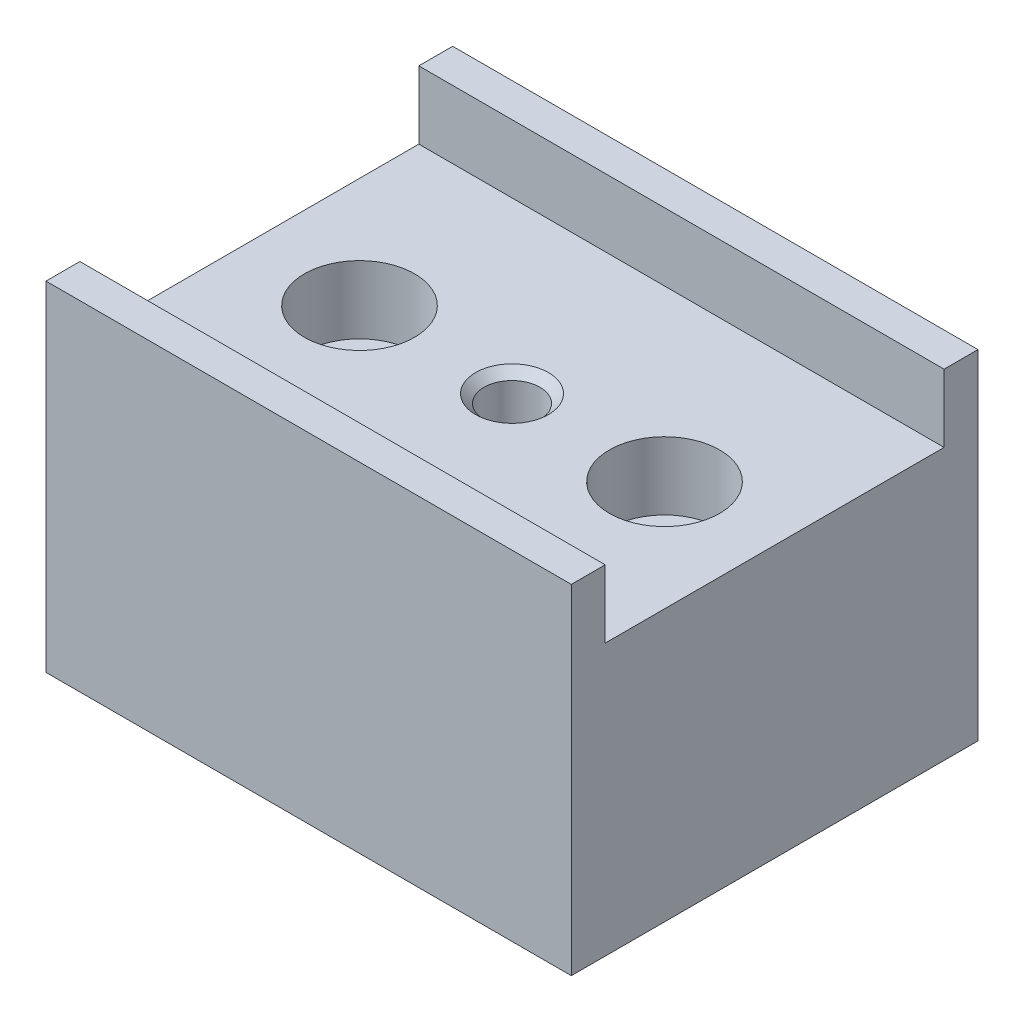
SolidWorks part; units mm, degrees
ref_plane "Спереди" through (0, 0, 0) normal (0, 0, 1) x (1, 0, 0)
ref_plane "Сверху" through (0, 0, 0) normal (0, 1, 0) x (1, 0, 0)
ref_plane "Справа" through (0, 0, 0) normal (1, 0, 0) x (0, 0, -1)
sketch "Эскиз1" plane through (0, 0, 0) normal (1, 0, 0) x (0, 0, -1)
  line L0 (0, 0) -> (0, 29.6441) construction
  line L1 (12, 0) -> (-12, 0)
  line L2 (-12, 0) -> (-12, 20)
  line L3 (-12, 20) -> (-10, 20)
  line L4 (-10, 20) -> (-10, 16)
  line L5 (-10, 16) -> (10, 16)
  line L6 (10, 20) -> (10, 16)
  line L7 (12, 20) -> (10, 20)
  line L8 (12, 0) -> (12, 20)
  point P9 (0, 16)
  dimension "D1" = 24
  dimension "D2" = 20
  dimension "D3" = 4
  dimension "D4" = 20
extrude "Бобышка-Вытянуть1" add sketch "Эскиз1" against normal blind 31
hole_wizard "Отверстие обработанное метчиком M41" positions "Эскиз3" profile "Эскиз2" tap size "M4" standard "DIN"
sketch "Эскиз3" plane through (0, 16, 0) normal (0, 1, 0) x (1, 0, 0)
  line L0 (-31, -12) -> (0, -12) construction
  point P0 (-15.5, 0)
  point P7 (-15.5, -12)
sketch "Эскиз2" plane through (-15.5, 16, 0) normal (1, 0, 0) x (0, 0, 1)
  line L0 (0, 0) -> (0, 16)
  line L1 (0, 16) -> (1.65, 16)
  line L2 (1.65, 16) -> (1.65, 0)
  line L5 (1.65, 0) -> (0, 0)
  line L11 (0, -6.35) -> (0, 107.95) construction
  dimension "Диаметр проходного сверла" = 3.3
  dimension "Глубина проходного сверла" = 16
chamfer "Фаска1" distance 0.5 angle 45 1 edges at (-15.5, 16, 1.65)
sketch "Эскиз4" plane through (0, 16, 0) normal (0, 1, 0) x (1, 0, 0)
  line L0 (-15.5, 12) -> (-15.5, -15.0211) construction
  line L1 (-31, 12) -> (0, 12) construction
  circle A0 centre (-24.5, 0) radius 1.7
  circle A1 centre (-6.5, 0) radius 1.7
  dimension "D1" = 18
  dimension "D2" = 3.4
extrude "Вырез-Вытянуть1" cut sketch "Эскиз4" against normal through all
sketch "Эскиз5" plane through (0, 16, 0) normal (0, 1, 0) x (1, 0, 0)
  circle A0 centre (-24.5, 0) radius 3.25
  circle A1 centre (-6.5, 0) radius 3.25
  dimension "D1" = 6.5
extrude "Вырез-Вытянуть2" cut sketch "Эскиз5" against normal blind 4
